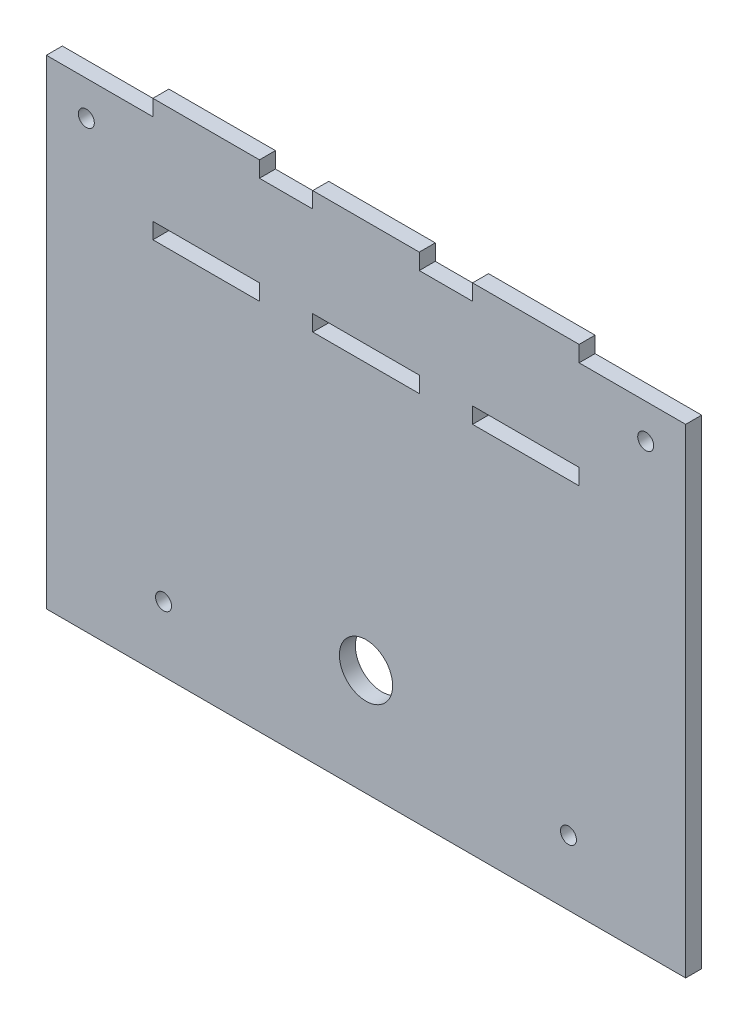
SolidWorks part; units mm, degrees
ref_plane "Plan de face" through (0, 0, 0) normal (0, 0, 1) x (1, 0, 0)
ref_plane "Plan de dessus" through (0, 0, 0) normal (0, 1, 0) x (1, 0, 0)
ref_plane "Plan de droite" through (0, 0, 0) normal (1, 0, 0) x (0, 0, -1)
sketch "Esquisse1" plane through (0, 0, 0) normal (0, 0, 1) x (1, 0, 0)
  line L0 (0, 0) -> (10, 0)
  line L1 (0, 0) -> (-10, 0)
  line L2 (10, 0) -> (10, -3)
  line L3 (-10, 0) -> (-10, -3)
  line L4 (10, -3) -> (20, -3)
  line L5 (-10, -3) -> (-20, -3)
  line L6 (20, -3) -> (20, 0)
  line L7 (-20, -3) -> (-20, 0)
  line L8 (-20, 0) -> (-40, 0)
  line L9 (20, 0) -> (40, 0)
  line L10 (-40, 0) -> (-40, -3)
  line L11 (-40, -3) -> (-60, -3)
  line L12 (40, 0) -> (40, -3)
  line L13 (40, -3) -> (60, -3)
  line L14 (0, -73) -> (0, -80.8) construction
  line L15 (0, 0) -> (0, -73)
  line L16 (60, -3) -> (52.5, -3) construction
  line L17 (52.5, -3) -> (52.5, -9.5) construction
  line L18 (0, -80.8) -> (38, -80.8) construction
  line L19 (0, 0) -> (0, -73) construction
  line L20 (60, -3) -> (60, -93)
  line L21 (60, -93) -> (-60, -93)
  line L22 (0, 0) -> (0, -20) construction
  line L23 (-10, -20) -> (10, -20)
  line L24 (10, -20) -> (10, -23)
  line L25 (10, -23) -> (-10, -23)
  line L26 (20, -20) -> (20, -23)
  line L27 (20, -23) -> (40, -23)
  line L28 (40, -23) -> (40, -20)
  line L29 (40, -20) -> (20, -20)
  line L30 (-60, -3) -> (-60, -93)
  line L31 (-40, -23) -> (-40, -20)
  line L32 (-20, -23) -> (-40, -23)
  line L33 (-20, -20) -> (-20, -23)
  line L34 (-40, -20) -> (-20, -20)
  line L35 (-10, -20) -> (-10, -23)
  circle A0 centre (52.5, -9.5) radius 1.5
  circle A1 centre (38, -80.8) radius 1.5
  circle A2 centre (-38, -80.8) radius 1.5
  circle A3 centre (-52.5, -9.5) radius 1.5
  circle A4 centre (0, -73) radius 5
  point P38 (0, -93)
  point P45 (0, -23)
  dimension "D17" = 3
  dimension "D19" = 3
  dimension "D13" = 10
  dimension "D1" = 10
  dimension "D2" = 10
  dimension "D3" = 3
  dimension "D4" = 3
  dimension "D5" = 10
  dimension "D6" = 10
  dimension "D7" = 40
  dimension "D8" = 20
  dimension "D9" = 73
  dimension "D10" = 20
  dimension "D11" = 3
  dimension "D12" = 3
  dimension "D14" = 7.8
  dimension "D15" = 7.5
  dimension "D16" = 6.5
  dimension "D18" = 38
  dimension "D20" = 73
  dimension "D21" = 90
  dimension "D22" = 20
  dimension "D23" = 3
  dimension "D24" = 20
  dimension "D25" = 3
  dimension "D26" = 20
  dimension "D27" = 20
  dimension "D28" = 10
extrude "Boss.-Extru.1" add sketch "Esquisse1" along normal blind 3
